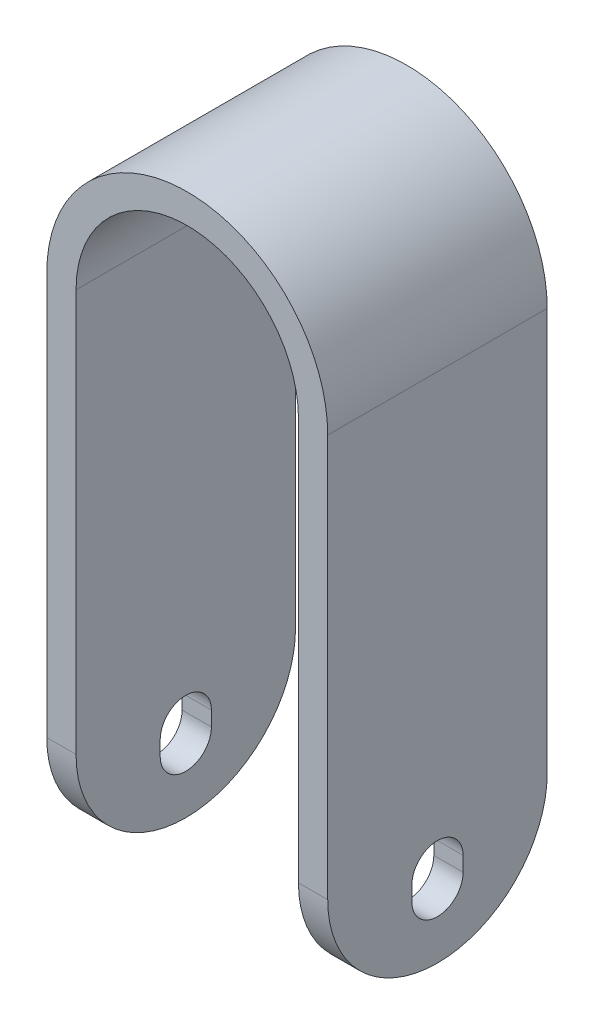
SolidWorks part; units mm, degrees
ref_plane "Plan1" through (0, 0, 0) normal (0, 0, 1) x (1, 0, 0)
ref_plane "Plan2" through (0, 0, 0) normal (0, 1, 0) x (1, 0, 0)
ref_plane "Plan3" through (0, 0, 0) normal (1, 0, 0) x (0, 0, -1)
sketch "Esquisse1" plane through (0, 0, 0) normal (0, 0, 1) x (1, 0, 0)
  line L0 (19.2, 0) -> (19.2, -70)
  line L1 (-19.2, 0) -> (-19.2, -70)
  line L2 (-19.2, -70) -> (-15.2, -70)
  line L3 (-15.2, 0) -> (-15.2, -70)
  line L4 (15.2, 0) -> (15.2, -70)
  line L5 (15.2, -70) -> (19.2, -70)
  arc A0 (15.2, 0) -> (-15.2, 0) centre (0, 0) ccw
  arc A1 (19.2, 0) -> (-19.2, 0) centre (0, 0) ccw
  dimension "D1" = 15.2
  dimension "D2" = 19.2
  dimension "D3" = 70
extrude "Base-Extrusion" add sketch "Esquisse1" along normal blind 30
fillet "Congé1" radius 15
sketch "Esquisse3" plane through (19.2, 0, 0) normal (1, 0, 0) x (0, 0, -1)
  line L0 (0, 0) -> (-37.2626, 0) construction
  line L1 (-30, 0) -> (0, 0) construction
  line L2 (-30, 0) -> (-30, -55) construction
  line L3 (-11.5, -59) -> (-11.5, -61)
  line L4 (-18.5, -59) -> (-18.5, -61)
  arc A0 (-18.5, -61) -> (-11.5, -61) centre (-15, -61) ccw
  arc A1 (-11.5, -59) -> (-18.5, -59) centre (-15, -59) ccw
  dimension "D1" = 3.5
  dimension "D2" = 61
  dimension "D3" = 15
  dimension "D4" = 2
extrude "Enlèv. mat.-Extru.1" cut sketch "Esquisse3" against normal blind 50
